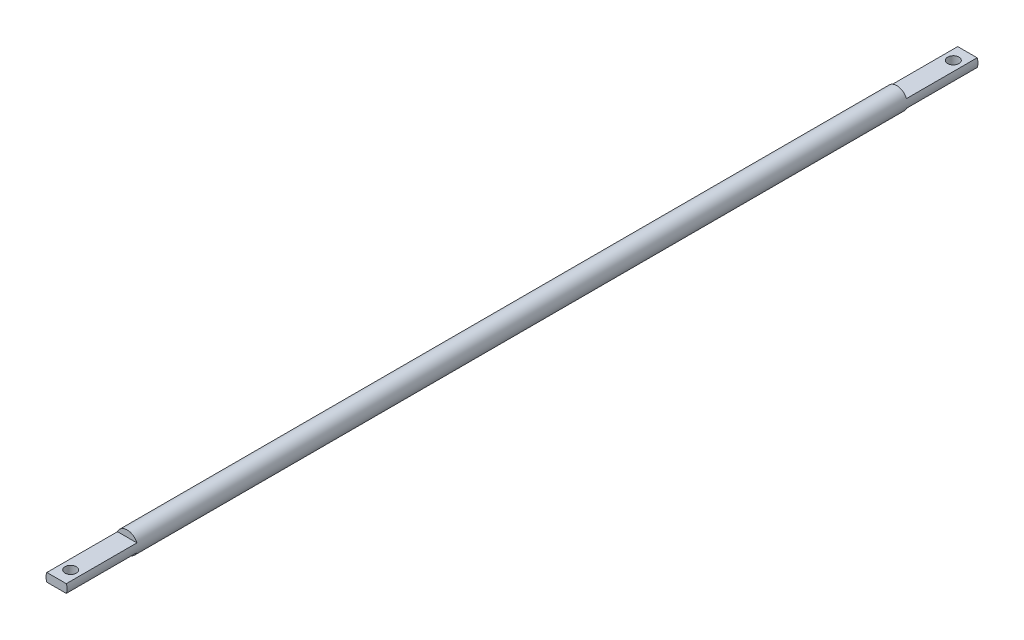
SolidWorks part; units mm, degrees
ref_plane "Face" through (0, 0, 0) normal (0, 0, 1) x (1, 0, 0)
ref_plane "Dessus" through (0, 0, 0) normal (0, 1, 0) x (1, 0, 0)
ref_plane "Droite" through (0, 0, 0) normal (1, 0, 0) x (0, 0, -1)
sketch "Esquisse1" plane through (0, 0, 0) normal (0, 0, 1) x (1, 0, 0)
  circle A0 centre (0, 0) radius 7.5
  dimension "D1" = 15
extrude "Base-Extrusion" add sketch "Esquisse1" along normal mid plane 645
sketch "Esquisse2" plane through (0, 0, 322.5) normal (0, 0, 1) x (1, 0, 0)
  line L0 (-9.6578, 0) -> (9.3996, 0) construction
  line L1 (-8.4139, 7.7174) -> (7.8506, 7.7174)
  line L2 (-8.4139, 7.7174) -> (-8.4139, 3)
  line L3 (-8.4139, 3) -> (7.8506, 3)
  line L4 (7.8506, 7.7174) -> (7.8506, 3)
  line L5 (7.8506, -7.7174) -> (7.8506, -3)
  line L6 (-8.4139, -3) -> (7.8506, -3)
  line L7 (-8.4139, -7.7174) -> (-8.4139, -3)
  line L8 (-8.4139, -7.7174) -> (7.8506, -7.7174)
  dimension "D1" = 3
extrude "Enlèv. mat.-Extru.1" cut sketch "Esquisse2" against normal blind 50
sketch "Esquisse5" plane through (0, 0, -322.5) normal (0, 0, -1) x (-1, 0, 0)
  line L1 (-8.2986, 8.8) -> (8.5278, 8.8)
  line L2 (-8.2986, 8.8) -> (-8.2986, 3)
  line L3 (-8.2986, 3) -> (8.5278, 3)
  line L4 (8.5278, 8.8) -> (8.5278, 3)
  line L6 (-8.2986, -3) -> (9.0804, -3)
  line L7 (-8.2986, -3) -> (-8.2986, -9.9074)
  line L8 (-8.2986, -9.9074) -> (9.0804, -9.9074)
  line L9 (9.0804, -3) -> (9.0804, -9.9074)
  dimension "D1" = 6
  dimension "D2" = 3
extrude "Enlèv. mat.-Extru.4" cut sketch "Esquisse5" against normal blind 50
sketch "Esquisse6" plane through (0, -3, 0) normal (0, -1, 0) x (1, 0, 0)
  line L0 (-7.5, 322.5) -> (-7.5, -322.5) construction
  line L2 (-6.8739, 322.5) -> (6.8739, 322.5) construction
  circle A0 centre (0, 312.5) radius 4
  dimension "D1" = 8
  dimension "D2" = 7.5
  dimension "D3" = 10
extrude "Enlèv. mat.-Extru.5" cut sketch "Esquisse6" against normal through all
sketch "Esquisse7" plane through (0, -3, 0) normal (0, 1, 0) x (-1, 0, 0)
  line L0 (6.8739, -322.5) -> (-6.8739, -322.5) construction
  circle A0 centre (0, -312.5) radius 4
  dimension "D1" = 8
  dimension "D2" = 10
extrude "Enlèv. mat.-Extru.6" cut sketch "Esquisse7" along normal through all
